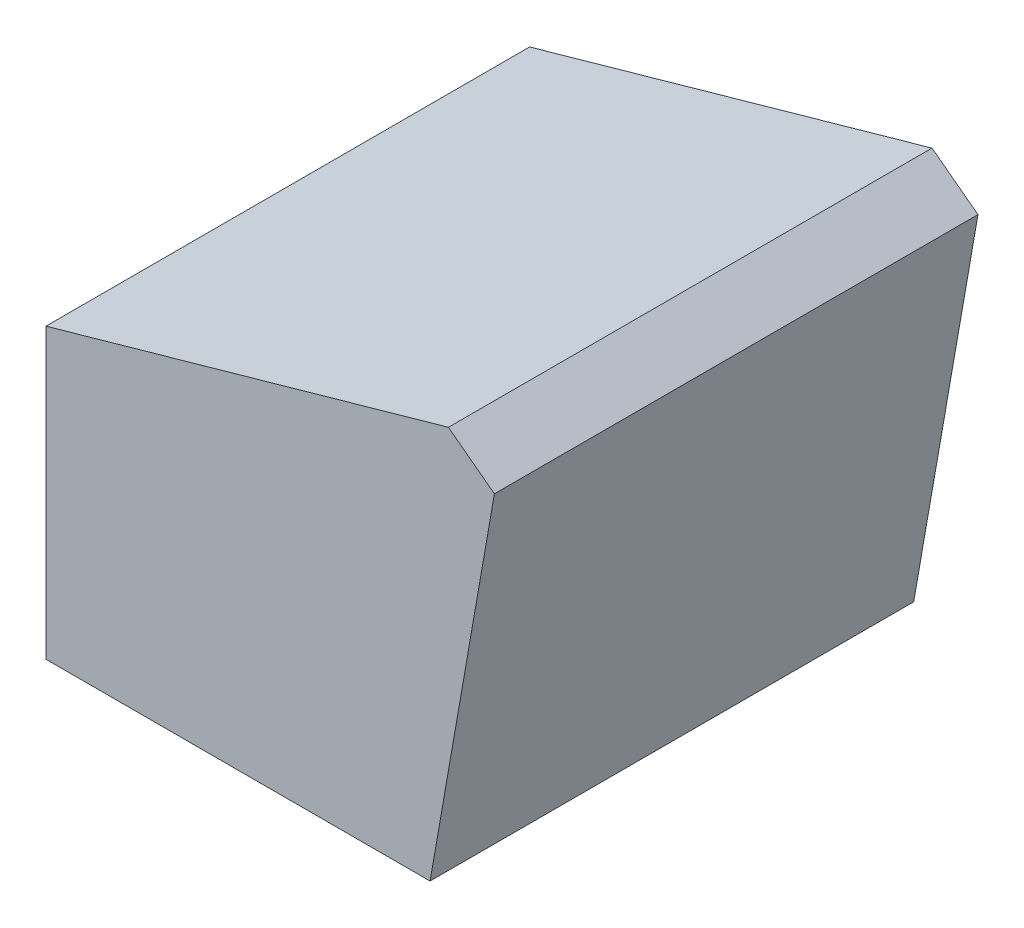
SolidWorks part; units mm, degrees
ref_plane "Front Plane" through (0, 0, 0) normal (0, 0, 1) x (1, 0, 0)
ref_plane "Top Plane" through (0, 0, 0) normal (0, 1, 0) x (1, 0, 0)
ref_plane "Right Plane" through (0, 0, 0) normal (1, 0, 0) x (0, 0, -1)
sketch "Sketch2" plane through (0, 0, 0) normal (0, 0, 1) x (1, 0, 0)
  line L0 (19.2437, 0) -> (-20.4666, 0)
  line L1 (-20.4666, 0) -> (-20.4666, 29.8316)
  line L2 (-20.4666, 29.8316) -> (26.7999, 43.1756)
  line L3 (26.7999, 43.1756) -> (19.2437, 0)
extrude "Boss-Extrude2" add sketch "Sketch2" along normal mid plane 50
fillet "Chamfer1" radius 4 1 edges at (26.7999, 43.1756, 0)
